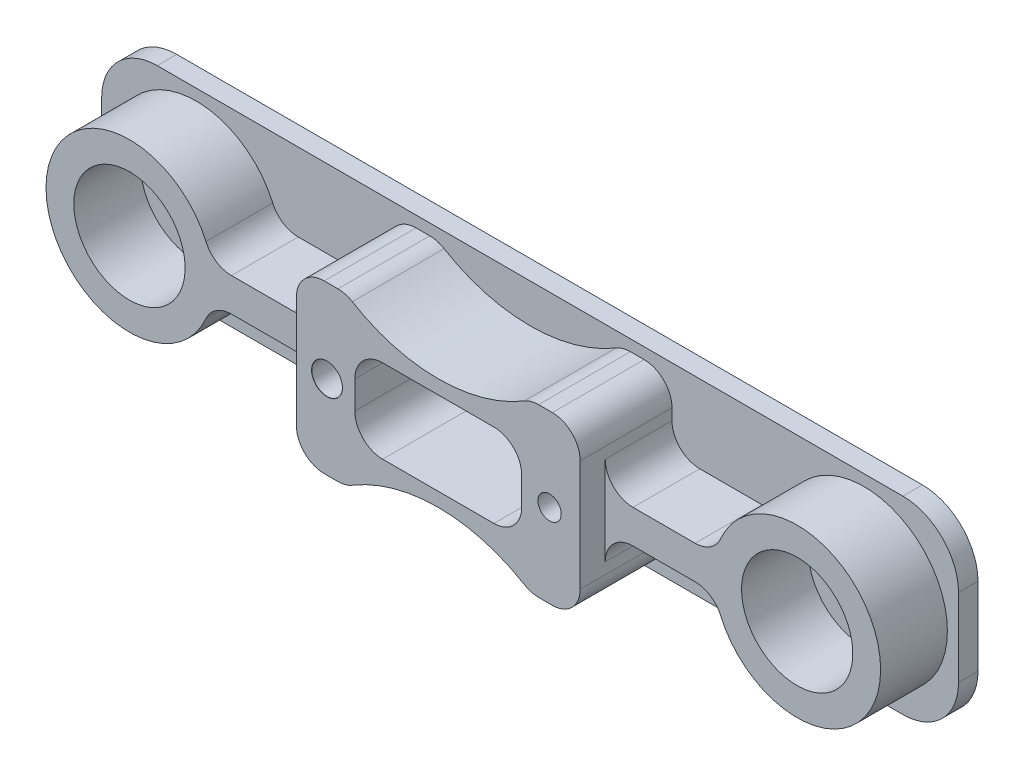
SolidWorks part; units mm, degrees
ref_plane "Vorne" through (0, 0, 0) normal (0, 0, 1) x (1, 0, 0)
ref_plane "Oben" through (0, 0, 0) normal (0, 1, 0) x (1, 0, 0)
ref_plane "Rechts" through (0, 0, 0) normal (1, 0, 0) x (0, 0, -1)
sketch "Skizze1" plane through (0, 0, 0) normal (0, 0, 1) x (1, 0, 0)
  line L1 (67, -17) -> (-67, -17)
  line L2 (77, -7) -> (77, 7)
  line L3 (67, 17) -> (-67, 17)
  line L4 (-77, -7) -> (-77, 7)
  line L5 (77, -17) -> (-77, 17) construction
  line L6 (77, 17) -> (-77, -17) construction
  arc A0 (67, -17) -> (77, -7) centre (67, -7) ccw
  arc A1 (77, 7) -> (67, 17) centre (67, 7) ccw
  arc A2 (-67, -17) -> (-77, -7) centre (-67, -7) cw
  arc A3 (-67, 17) -> (-77, 7) centre (-67, 7) ccw
  point P0 (0, 0)
  dimension "D3" = 10
  dimension "D1" = 34
  dimension "D2" = 154
extrude "Aufsatz-Linear austragen1" add sketch "Skizze1" along normal blind 3.5
sketch "Skizze2" plane through (0, 0, 3.5) normal (0, 0, 1) x (1, 0, 0)
  line L1 (-10, 7.5) -> (10, 7.5)
  line L2 (-15, 2.5) -> (-15, -2.5)
  line L3 (-10, -7.5) -> (10, -7.5)
  line L4 (15, 2.5) -> (15, -2.5)
  line L5 (-15, 7.5) -> (15, -7.5) construction
  line L6 (-15, -7.5) -> (15, 7.5) construction
  line L7 (-20.5, -15) -> (20.5, -15)
  line L8 (-25.5, -10) -> (-25.5, 10)
  line L9 (-20.5, 15) -> (20.5, 15)
  line L10 (25.5, -10) -> (25.5, 10)
  line L11 (-25.5, -15) -> (25.5, 15) construction
  line L12 (-25.5, 15) -> (25.5, -15) construction
  arc A0 (10, -7.5) -> (15, -2.5) centre (10, -2.5) ccw
  arc A1 (-15, -2.5) -> (-10, -7.5) centre (-10, -2.5) ccw
  arc A2 (-10, 7.5) -> (-15, 2.5) centre (-10, 2.5) ccw
  arc A3 (10, 7.5) -> (15, 2.5) centre (10, 2.5) cw
  arc A4 (-20.5, -15) -> (-25.5, -10) centre (-20.5, -10) cw
  arc A5 (20.5, -15) -> (25.5, -10) centre (20.5, -10) ccw
  arc A6 (20.5, 15) -> (25.5, 10) centre (20.5, 10) cw
  arc A7 (-25.5, 10) -> (-20.5, 15) centre (-20.5, 10) cw
  point P0 (0, 0)
  point P6 (0, 0)
  dimension "D5" = 5
  dimension "D1" = 51
  dimension "D2" = 30
  dimension "D4" = 15
extrude "Aufsatz-Linear austragen2" add sketch "Skizze2" along normal blind 16.5
sketch "Skizze3" plane through (0, 0, 20) normal (0, 0, 1) x (1, 0, 0)
  line L0 (-25.5, 0) -> (25.5, 0) construction
  line L1 (-25.5, 10) -> (-25.5, -10) construction
  line L2 (25.5, -10) -> (25.5, 10) construction
  line L4 (0, 40) -> (0, -40) construction
  circle A0 centre (0, -40) radius 30
  circle A1 centre (0, 40) radius 30
  dimension "D1" = 60
  dimension "D2" = 40
extrude "Schnitt-Linear austragen2" cut sketch "Skizze3" against normal up to surface (16.5 mm away)
fillet "Verrundung1" radius 5 4 edges at (16.5831, -15, 11.75) (-16.5831, -15, 11.75) (-16.5831, 15, 11.75) (16.5831, 15, 11.75)
sketch "Skizze4" plane through (0, 0, 3.5) normal (0, 0, 1) x (1, 0, 0)
  line L0 (0, 17) -> (0, -17) construction
  line L1 (67, 17) -> (-67, 17) construction
  line L2 (-67, -17) -> (67, -17) construction
  line L3 (-25.5, 0) -> (-60, 0) construction
  line L4 (-25.5, 0) -> (0, 0) construction
  line L5 (25.5, 0) -> (0, 0) construction
  line L6 (-25.5, 3) -> (-45.3031, 3)
  line L7 (25.5, 0) -> (60, 0) construction
  line L8 (-25.5, -3) -> (-45.3031, -3)
  line L9 (-25.5, 3) -> (-25.5, -3)
  line L10 (-25.5, 10) -> (-25.5, -10) construction
  line L11 (25.5, 3) -> (25.5, -3)
  line L12 (-25.5, 3) -> (-60, 3) construction
  line L13 (-25.5, -3) -> (-60, -3) construction
  line L14 (25.5, -3) -> (45.3031, -3)
  line L15 (-25.5, -3) -> (0, -3) construction
  line L16 (-25.5, 3) -> (0, 3) construction
  line L17 (25.5, 3) -> (45.3031, 3)
  arc A0 (-45.3031, 3) -> (-45.3031, -3) centre (-60, 0) ccw
  circle A1 centre (-60, 0) radius 10
  circle A2 centre (60, 0) radius 10
  arc A3 (45.3031, 3) -> (45.3031, -3) centre (60, 0) cw
  dimension "D2" = 20
  dimension "D3" = 120
  dimension "D4" = 3
  dimension "D5" = 3
extrude "Aufsatz-Linear austragen3" add sketch "Skizze4" along normal blind 12
fillet "Verrundung2" radius 5 8 edges at (45.3031, -3, 9.5) (25.5, -3, 9.5) (-45.3031, -3, 9.5) (-25.5, -3, 9.5) (-25.5, 3, 9.5) (45.3031, 3, 9.5) (25.5, 3, 9.5) (-45.3031, 3, 9.5)
hole_wizard "Formsenkung für M5 Senkschraube mit Innensechskant1" positions "Skizze6" profile "Skizze5" countersink size "M5" standard "DIN"
sketch "Skizze6" plane through (0, 0, 0) normal (0, 0, -1) x (-1, 0, 0)
  point P0 (20, 0)
  dimension "D1" = 20
sketch "Skizze5" plane through (-20, 0, 0) normal (1, 0, 0) x (0, 1, 0)
  line L0 (0, 0) -> (0, 20)
  line L1 (0, 20) -> (2.775, 20)
  line L3 (2.75, 2.95) -> (5.2, 0.5)
  line L4 (5.2, 0.5) -> (5.2, 0)
  line L6 (5.2, 0) -> (0, 0)
  line L7 (-2.75, 2.95) -> (-5.2, 0.5) construction
  line L8 (2.775, 20) -> (2.75, 19.975)
  line L9 (2.75, 19.975) -> (2.75, 2.95)
  line L10 (-2.775, 20) -> (-2.75, 19.975) construction
  line L11 (0, -6.35) -> (0, 107.95) construction
  dimension "Bohrerdurchmesser" = 5.5
  dimension "Bohrungstiefe" = 20
  dimension "Senkdurchmesser2" = 10.4
  dimension "Senkwinkel2" = 90
  dimension "Senkdurchmesser2 (Unten)" = 5.55
  dimension "Senkwinkel2 (Unten)" = 90
  dimension "Kopfspielraum" = 0.5
hole_wizard "M5 Gewindebohrung1" positions "Skizze8" profile "Skizze7" tap size "M5" standard "DIN"
sketch "Skizze8" plane through (0, 0, 20) normal (0, 0, 1) x (1, 0, 0)
  point P0 (20, 0)
  dimension "D1" = 20
sketch "Skizze7" plane through (20, 0, 20) normal (1, 0, 0) x (0, -1, 0)
  line L0 (0, 0) -> (0, 18.2618)
  line L1 (0, 18.2618) -> (2.1, 17)
  line L2 (2.1, 17) -> (2.1, 0)
  line L5 (2.1, 0) -> (0, 0)
  line L10 (0, 18.2618) -> (-2.1, 17) construction
  line L11 (0, -6.35) -> (0, 107.95) construction
  dimension "Bohrerdurchmesser" = 4.2
  dimension "Bohrungstiefe" = 17
  dimension "Spitzenwinkel" = 118
